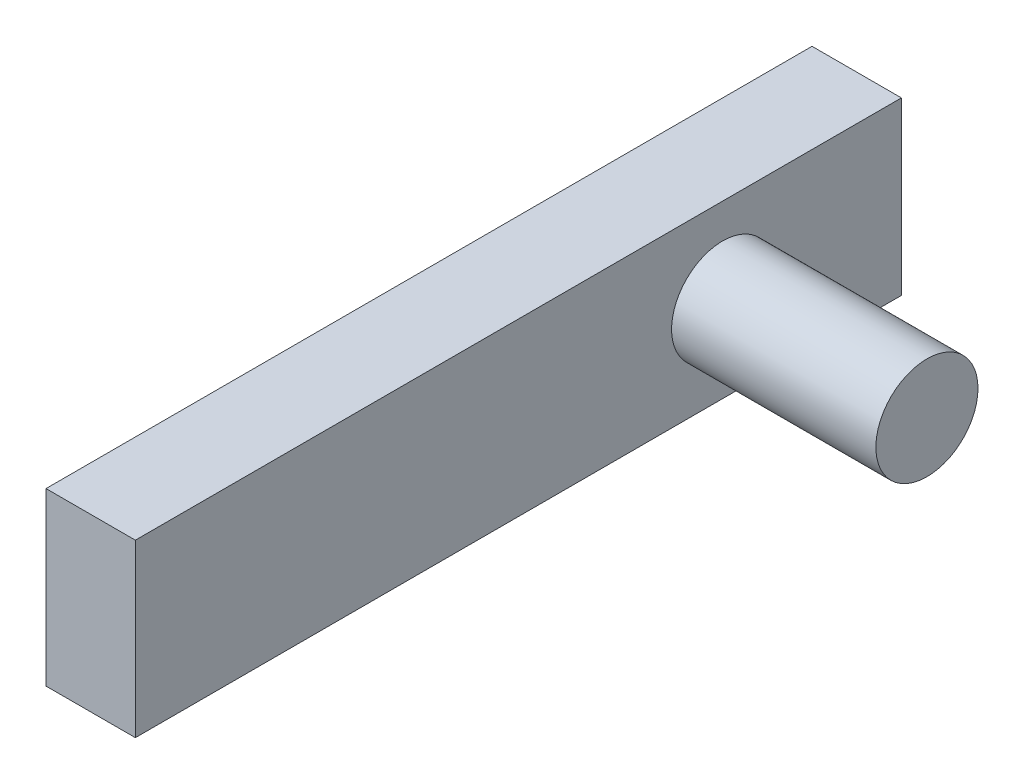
SolidWorks part; units mm, degrees
ref_plane "Front" through (0, 0, 0) normal (0, 0, 1) x (1, 0, 0)
ref_plane "Top" through (0, 0, 0) normal (0, 1, 0) x (1, 0, 0)
ref_plane "Right" through (0, 0, 0) normal (1, 0, 0) x (0, 0, -1)
sketch "Sketch1" plane through (0, 0, 0) normal (1, 0, 0) x (0, 0, -1)
  line L1 (15, -3.35) -> (-15, -3.35)
  line L2 (15, -3.35) -> (15, 3.35)
  line L3 (15, 3.35) -> (-15, 3.35)
  line L4 (-15, -3.35) -> (-15, 3.35)
  line L5 (15, -3.35) -> (-15, 3.35) construction
  line L6 (15, 3.35) -> (-15, -3.35) construction
  point P0 (0, 0)
  dimension "D1" = 6.7
  dimension "D2" = 30
extrude "Boss-Extrude1" add sketch "Sketch1" along normal blind 3.5
sketch "Sketch2" plane through (3.5, 0, 0) normal (1, 0, 0) x (0, 0, -1)
  line L0 (50, 0) -> (-50, 0) construction
  line L1 (0, 50) -> (0, -50) construction
  circle A0 centre (8, 0) radius 2
  dimension "D1" = 8
  dimension "D2" = 4
extrude "Boss-Extrude2" add sketch "Sketch2" along normal blind 8
